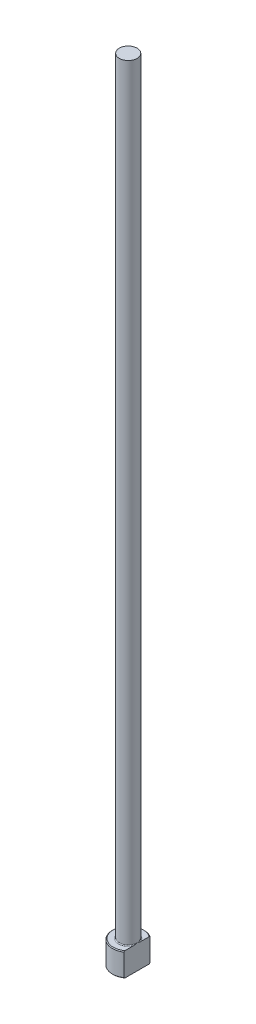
SolidWorks part; units mm, degrees
ref_plane "Front Plane" through (0, 0, 0) normal (0, 0, 1) x (1, 0, 0)
ref_plane "Top Plane" through (0, 0, 0) normal (0, 1, 0) x (1, 0, 0)
ref_plane "Right Plane" through (0, 0, 0) normal (1, 0, 0) x (0, 0, -1)
sketch "Sketch1" plane through (0, 0, 0) normal (0, 0, 1) x (1, 0, 0)
  line L0 (0, 259.9588) -> (0, -15.1925) construction
  line L1 (0, 0) -> (-4, 0)
  line L2 (-4, 0) -> (-4, 6)
  line L3 (-4, 6) -> (-2.25, 6)
  line L4 (-2.25, 6) -> (-2.25, 200)
  line L5 (-2.25, 200) -> (0, 200)
  line L6 (0, 200) -> (0, 0)
  dimension "L" = 200
  dimension "H" = 8
  dimension "T" = 6
  dimension "D" = 4.5
revolve "Revolve1" add sketch "Sketch1" angle 360 about L0
chamfer "Chamfer1" distance 0.2 angle 45 2 edges at (0, 6, 4) (0, 0, 4)
fillet "Fillet1" radius 0.2 1 edges at (0, 6, 2.25)
sketch "Sketch2" plane through (0, 0, 0) normal (0, 1, 0) x (1, 0, 0)
  line L0 (2.25, -3.3072) -> (2.25, 3.3072)
  circle A0 centre (0, 0) radius 4 construction
  arc A1 (2.25, -3.3072) -> (2.25, 3.3072) centre (0, 0) ccw
  circle A2 centre (0, 0) radius 2.25 construction
extrude "KEYED HEAD" cut sketch "Sketch2" along normal through all
